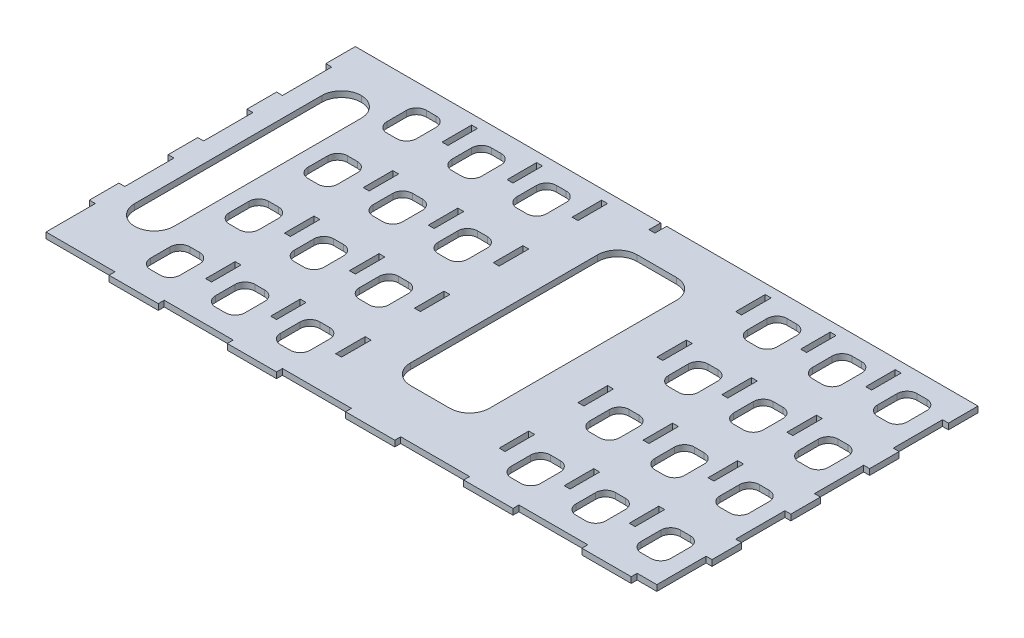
SolidWorks part; units mm, degrees
ref_plane "Front Plane" through (0, 0, 0) normal (0, 0, 1) x (1, 0, 0)
ref_plane "Top Plane" through (0, 0, 0) normal (0, 1, 0) x (1, 0, 0)
ref_plane "Right Plane" through (0, 0, 0) normal (1, 0, 0) x (0, 0, -1)
sketch "Sketch1" plane through (0, 0, 0) normal (0, 1, 0) x (1, 0, 0)
  line L0 (0, 0) -> (310, 0)
  line L1 (310, 0) -> (310, 160)
  line L2 (310, 160) -> (0, 160)
  line L3 (0, 160) -> (0, 0)
extrude "Boss-Extrude1" add sketch "Sketch1" along normal blind 3
sketch "Sketch2" plane through (0, 3, 0) normal (0, 1, 0) x (1, 0, 0)
  line L0 (0, 0) -> (35, 0) construction
  line L1 (0, 0) -> (310, 0) construction
  line L2 (35, 0) -> (60, 0) construction
  line L3 (60, 0) -> (95, 0) construction
  line L4 (95, 0) -> (120, 0) construction
  line L5 (120, 0) -> (155, 0) construction
  line L6 (155, 0) -> (180, 0) construction
  line L7 (180, 0) -> (215, 0) construction
  line L8 (215, 0) -> (240, 0) construction
  line L9 (240, 0) -> (275, 0) construction
  line L10 (275, 0) -> (300, 0) construction
  line L11 (35, 0) -> (35, -3)
  line L12 (35, -3) -> (60, -3)
  line L13 (60, -3) -> (60, 0)
  line L14 (60, 0) -> (35, 0)
  line L15 (95, 0) -> (95, -3)
  line L16 (95, -3) -> (120, -3)
  line L17 (120, -3) -> (120, 0)
  line L18 (120, 0) -> (95, 0)
  line L19 (155, 0) -> (155, -3)
  line L20 (155, -3) -> (180, -3)
  line L21 (180, -3) -> (180, 0)
  line L22 (180, 0) -> (155, 0)
  line L23 (215, 0) -> (215, -3)
  line L24 (215, -3) -> (240, -3)
  line L25 (240, -3) -> (240, 0)
  line L26 (240, 0) -> (215, 0)
  line L27 (275, 0) -> (275, -3)
  line L28 (275, -3) -> (300, -3)
  line L29 (300, -3) -> (300, 0)
  line L30 (300, 0) -> (275, 0)
  dimension "D1" = 35
  dimension "D2" = 25
  dimension "D3" = 35
  dimension "D4" = 25
  dimension "D5" = 35
  dimension "D6" = 25
  dimension "D7" = 35
  dimension "D8" = 25
  dimension "D9" = 35
  dimension "D10" = 25
extrude "Boss-Extrude2" add sketch "Sketch2" against normal blind 3
sketch "Sketch3" plane through (0, 3, 0) normal (0, 1, 0) x (1, 0, 0)
  line L0 (0, 0) -> (0, 25) construction
  line L1 (0, 160) -> (0, 0) construction
  line L2 (0, 25) -> (0, 40) construction
  line L3 (0, 40) -> (0, 65) construction
  line L4 (0, 65) -> (0, 80) construction
  line L5 (0, 80) -> (0, 105) construction
  line L6 (0, 105) -> (0, 120) construction
  line L7 (0, 120) -> (0, 145) construction
  line L8 (0, 145) -> (0, 160) construction
  line L9 (0, 160) -> (-3, 160)
  line L10 (-3, 160) -> (-3, 145)
  line L11 (-3, 145) -> (0, 145)
  line L12 (0, 160) -> (0, 145)
  line L13 (0, 120) -> (-3, 120)
  line L14 (-3, 120) -> (-3, 105)
  line L15 (-3, 105) -> (0, 105)
  line L16 (0, 105) -> (0, 120)
  line L17 (0, 80) -> (-3, 80)
  line L18 (-3, 80) -> (-3, 65)
  line L19 (-3, 65) -> (0, 65)
  line L20 (0, 65) -> (0, 80)
  line L21 (0, 40) -> (-3, 40)
  line L22 (-3, 40) -> (-3, 25)
  line L23 (-3, 25) -> (0, 25)
  line L24 (0, 25) -> (0, 40)
  line L25 (155, 0) -> (155, 160.4343) construction
  line L27 (310, 145) -> (310, 160) construction
  line L28 (310, 120) -> (310, 145) construction
  line L29 (310, 105) -> (310, 120) construction
  line L30 (310, 80) -> (310, 105) construction
  line L31 (310, 65) -> (310, 80) construction
  line L32 (310, 40) -> (310, 65) construction
  line L33 (310, 25) -> (310, 40) construction
  line L34 (310, 0) -> (310, 25) construction
  line L35 (310, 25) -> (310, 40)
  line L36 (313, 25) -> (310, 25)
  line L37 (313, 40) -> (313, 25)
  line L38 (310, 40) -> (313, 40)
  line L39 (310, 65) -> (310, 80)
  line L40 (313, 65) -> (310, 65)
  line L41 (313, 80) -> (313, 65)
  line L42 (310, 80) -> (313, 80)
  line L43 (310, 105) -> (310, 120)
  line L44 (313, 105) -> (310, 105)
  line L45 (313, 120) -> (313, 105)
  line L46 (310, 120) -> (313, 120)
  line L47 (310, 160) -> (310, 145)
  line L48 (313, 145) -> (310, 145)
  line L49 (313, 160) -> (313, 145)
  line L50 (310, 160) -> (313, 160)
  dimension "D1" = 25
  dimension "D2" = 15
  dimension "D3" = 25
  dimension "D4" = 15
  dimension "D5" = 25
  dimension "D6" = 15
  dimension "D7" = 25
extrude "Boss-Extrude3" add sketch "Sketch3" against normal blind 3
sketch "Sketch4" plane through (0, 3, 0) normal (0, 1, 0) x (1, 0, 0)
  line L0 (155, 80) -> (180, 80) construction
  line L1 (279, 0) -> (279, 160) construction
  line L2 (0, 0) -> (35, 0) construction
  line L3 (313, 160) -> (-3, 160) construction
  line L4 (279, 80) -> (246, 80) construction
  line L5 (246, 0) -> (246, 160) construction
  line L6 (246, 80) -> (213, 80) construction
  line L7 (213, 0) -> (213, 160) construction
  line L8 (180, 0) -> (180, 160) construction
  line L9 (155, 0) -> (155, 160) construction
  line L11 (180, 80) -> (213, 80) construction
  line L12 (155, 80) -> (130, 80) construction
  line L13 (130, 80) -> (97, 80) construction
  line L14 (97, 80) -> (64, 80) construction
  line L15 (130, 60) -> (130, 75) construction
  line L16 (97, 0) -> (97, 160) construction
  line L17 (64, 0) -> (64, 160) construction
  line L18 (130, 0) -> (130, 20) construction
  line L19 (130, 20) -> (130, 35) construction
  line L20 (130, 35) -> (130, 60) construction
  line L21 (130, 75) -> (130, 100) construction
  line L22 (130, 100) -> (130, 115) construction
  line L23 (130, 115) -> (130, 140) construction
  line L24 (130, 140) -> (130, 155) construction
  line L25 (130, 20) -> (130, 35)
  line L26 (130, 35) -> (127, 35)
  line L27 (127, 35) -> (127, 20)
  line L28 (127, 20) -> (130, 20)
  line L29 (130, 60) -> (127, 60)
  line L30 (127, 60) -> (127, 75)
  line L31 (127, 75) -> (130, 75)
  line L32 (130, 75) -> (130, 60)
  line L33 (130, 100) -> (130, 115)
  line L34 (130, 115) -> (127, 115)
  line L35 (127, 115) -> (127, 100)
  line L36 (127, 100) -> (130, 100)
  line L37 (130, 140) -> (130, 155)
  line L38 (130, 155) -> (127, 155)
  line L39 (127, 155) -> (127, 140)
  line L40 (127, 140) -> (130, 140)
  line L41 (94, 35) -> (94, 20)
  line L42 (94, 20) -> (97, 20)
  line L43 (97, 20) -> (97, 35)
  line L44 (97, 35) -> (94, 35)
  line L45 (94, 60) -> (94, 75)
  line L46 (97, 75) -> (97, 60)
  line L47 (97, 60) -> (94, 60)
  line L48 (94, 75) -> (97, 75)
  line L49 (94, 115) -> (94, 100)
  line L50 (94, 100) -> (97, 100)
  line L51 (97, 100) -> (97, 115)
  line L52 (97, 115) -> (94, 115)
  line L53 (94, 155) -> (94, 140)
  line L54 (94, 140) -> (97, 140)
  line L55 (97, 140) -> (97, 155)
  line L56 (97, 155) -> (94, 155)
  line L57 (61, 35) -> (61, 20)
  line L58 (61, 20) -> (64, 20)
  line L59 (64, 20) -> (64, 35)
  line L60 (64, 35) -> (61, 35)
  line L61 (61, 60) -> (61, 75)
  line L62 (64, 75) -> (64, 60)
  line L63 (64, 60) -> (61, 60)
  line L64 (61, 75) -> (64, 75)
  line L65 (61, 115) -> (61, 100)
  line L66 (61, 100) -> (64, 100)
  line L67 (64, 100) -> (64, 115)
  line L68 (64, 115) -> (61, 115)
  line L69 (61, 155) -> (61, 140)
  line L70 (61, 140) -> (64, 140)
  line L71 (64, 140) -> (64, 155)
  line L72 (64, 155) -> (61, 155)
  line L73 (213, 20) -> (213, 35)
  line L74 (213, 35) -> (210, 35)
  line L75 (210, 35) -> (210, 20)
  line L76 (210, 20) -> (213, 20)
  line L77 (213, 60) -> (210, 60)
  line L78 (210, 60) -> (210, 75)
  line L79 (210, 75) -> (213, 75)
  line L80 (213, 75) -> (213, 60)
  line L81 (213, 100) -> (213, 115)
  line L82 (213, 115) -> (210, 115)
  line L83 (210, 115) -> (210, 100)
  line L84 (210, 100) -> (213, 100)
  line L85 (213, 140) -> (213, 155)
  line L86 (210, 155) -> (210, 140)
  line L87 (210, 140) -> (213, 140)
  line L88 (238, 80) -> (213, 80) construction
  line L89 (213, 80) -> (180, 80) construction
  line L90 (213, 60) -> (213, 75) construction
  line L91 (213, 0) -> (213, 20) construction
  line L92 (213, 20) -> (213, 35) construction
  line L93 (213, 35) -> (213, 60) construction
  line L94 (213, 75) -> (213, 100) construction
  line L95 (213, 100) -> (213, 115) construction
  line L96 (213, 115) -> (213, 140) construction
  line L97 (213, 140) -> (213, 155) construction
  line L98 (246, 20) -> (246, 35)
  line L99 (246, 35) -> (243, 35)
  line L100 (243, 35) -> (243, 20)
  line L101 (243, 20) -> (246, 20)
  line L102 (246, 60) -> (243, 60)
  line L103 (243, 60) -> (243, 75)
  line L104 (243, 75) -> (246, 75)
  line L105 (246, 75) -> (246, 60)
  line L106 (246, 100) -> (246, 115)
  line L107 (246, 115) -> (243, 115)
  line L108 (243, 115) -> (243, 100)
  line L109 (243, 100) -> (246, 100)
  line L110 (246, 140) -> (246, 155)
  line L111 (243, 155) -> (243, 140)
  line L112 (243, 140) -> (246, 140)
  line L113 (246, 60) -> (246, 75) construction
  line L114 (246, 20) -> (246, 35) construction
  line L115 (246, 35) -> (246, 60) construction
  line L116 (246, 75) -> (246, 100) construction
  line L117 (246, 100) -> (246, 115) construction
  line L118 (246, 115) -> (246, 140) construction
  line L119 (246, 140) -> (246, 155) construction
  line L120 (279, 20) -> (279, 35)
  line L121 (279, 35) -> (276, 35)
  line L122 (276, 35) -> (276, 20)
  line L123 (276, 20) -> (279, 20)
  line L124 (279, 60) -> (276, 60)
  line L125 (276, 60) -> (276, 75)
  line L126 (276, 75) -> (279, 75)
  line L127 (279, 75) -> (279, 60)
  line L128 (279, 100) -> (279, 115)
  line L129 (279, 115) -> (276, 115)
  line L130 (276, 115) -> (276, 100)
  line L131 (276, 100) -> (279, 100)
  line L132 (279, 140) -> (279, 155)
  line L133 (276, 155) -> (276, 140)
  line L134 (276, 140) -> (279, 140)
  line L135 (279, 60) -> (279, 75) construction
  line L136 (279, 20) -> (279, 35) construction
  line L137 (279, 35) -> (279, 60) construction
  line L138 (279, 75) -> (279, 100) construction
  line L139 (279, 100) -> (279, 115) construction
  line L140 (279, 115) -> (279, 140) construction
  line L141 (279, 140) -> (279, 155) construction
  line L142 (210, 155) -> (213, 155)
  line L143 (243, 155) -> (246, 155)
  line L144 (276, 155) -> (279, 155)
  dimension "D1" = 33
  dimension "D2" = 33
  dimension "D3" = 33
  dimension "D4" = 25
  dimension "D5" = 25
  dimension "D6" = 33
  dimension "D7" = 20
  dimension "D8" = 15
  dimension "D9" = 25
  dimension "D10" = 20
  dimension "D11" = 15
  dimension "D12" = 15
  dimension "D13" = 25
  dimension "D14" = 15
  dimension "D15" = 3
  dimension "D16" = 2
  dimension "D17" = 3
extrude "Cut-Extrude1" cut sketch "Sketch4" against normal blind 10
sketch "Sketch5" plane through (0, 3, 0) normal (0, 1, 0) x (1, 0, 0)
  line L0 (210, 67.5) -> (130, 67.5) construction
  line L1 (210, 75) -> (210, 60) construction
  line L2 (130, 60) -> (130, 75) construction
  line L3 (170, 140) -> (150, 140)
  line L4 (313, 160) -> (-3, 160) construction
  line L5 (170, 113.75) -> (150, 113.75) construction
  line L6 (170, 160) -> (170, 140) construction
  line L7 (150, 140) -> (150, 25)
  line L8 (150, 25) -> (190, 25)
  line L9 (190, 25) -> (190, 140)
  line L10 (190, 140) -> (170, 140)
  line L11 (30, 140) -> (10, 140)
  line L12 (10, 140) -> (10, 25)
  line L16 (30, 113.75) -> (10, 113.75) construction
  line L17 (50, 25) -> (50, 140)
  line L18 (50, 140) -> (30, 140)
  line L19 (10, 25) -> (50, 25)
  line L20 (30, 140) -> (30, 25)
  line L21 (30, 25) -> (10, 25)
  dimension "D1" = 2
extrude "Cut-Extrude2" cut sketch "Sketch5" against normal blind 10
fillet "Fillet1" radius 10 8 edges at (150, 1.5, -140) (190, 1.5, -140) (190, 1.5, -25) (150, 1.5, -25) (30, 1.5, -140) (10, 1.5, -140) (30, 1.5, -25) (10, 1.5, -25)
sketch "Sketch6" plane through (0, 3, 0) normal (0, 1, 0) x (1, 0, 0)
  line L0 (61, 20) -> (61, 0) construction
  line L1 (0, 0) -> (35, 0) construction
  line L2 (61, 10) -> (53, 10) construction
  line L3 (53, 10) -> (53, 30)
  line L4 (53, 30) -> (38, 30)
  line L5 (38, 30) -> (38, 10)
  line L6 (38, 10) -> (53, 10)
  line L7 (71, 10) -> (86, 10)
  line L8 (71, 30) -> (71, 10)
  line L9 (86, 30) -> (71, 30)
  line L10 (86, 10) -> (86, 30)
  line L11 (104, 10) -> (119, 10)
  line L12 (104, 30) -> (104, 10)
  line L13 (119, 30) -> (104, 30)
  line L14 (119, 10) -> (119, 30)
  line L15 (71, 50) -> (86, 50)
  line L16 (71, 70) -> (71, 50)
  line L17 (86, 70) -> (71, 70)
  line L18 (86, 50) -> (86, 70)
  line L19 (104, 50) -> (119, 50)
  line L20 (104, 70) -> (104, 50)
  line L21 (119, 70) -> (104, 70)
  line L22 (119, 50) -> (119, 70)
  line L23 (71, 90) -> (86, 90)
  line L24 (71, 110) -> (71, 90)
  line L25 (86, 110) -> (71, 110)
  line L26 (86, 90) -> (86, 110)
  line L27 (104, 90) -> (119, 90)
  line L28 (104, 110) -> (104, 90)
  line L29 (119, 110) -> (104, 110)
  line L30 (119, 90) -> (119, 110)
  line L31 (71, 130) -> (86, 130)
  line L32 (71, 150) -> (71, 130)
  line L33 (86, 150) -> (71, 150)
  line L34 (86, 130) -> (86, 150)
  line L35 (104, 130) -> (119, 130)
  line L36 (104, 150) -> (104, 130)
  line L37 (119, 150) -> (104, 150)
  line L38 (119, 130) -> (119, 150)
  line L39 (38, 50) -> (53, 50)
  line L40 (38, 70) -> (38, 50)
  line L41 (53, 70) -> (38, 70)
  line L42 (53, 50) -> (53, 70)
  line L43 (38, 90) -> (53, 90)
  line L44 (38, 110) -> (38, 90)
  line L45 (53, 110) -> (38, 110)
  line L46 (53, 90) -> (53, 110)
  line L47 (38, 130) -> (53, 130)
  line L48 (38, 150) -> (38, 130)
  line L49 (53, 150) -> (38, 150)
  line L50 (53, 130) -> (53, 150)
  line L51 (279, 20) -> (279, 0) construction
  line L52 (279, 10) -> (287, 10) construction
  line L53 (287, 10) -> (287, 30)
  line L54 (287, 30) -> (302, 30)
  line L55 (302, 30) -> (302, 10)
  line L56 (302, 10) -> (287, 10)
  line L57 (254, 10) -> (254, 30)
  line L58 (269, 10) -> (254, 10)
  line L59 (254, 30) -> (269, 30)
  line L60 (269, 30) -> (269, 10)
  line L61 (221, 10) -> (221, 30)
  line L62 (236, 10) -> (221, 10)
  line L63 (221, 30) -> (236, 30)
  line L64 (236, 30) -> (236, 10)
  line L65 (254, 50) -> (254, 70)
  line L66 (269, 50) -> (254, 50)
  line L67 (254, 70) -> (269, 70)
  line L68 (269, 70) -> (269, 50)
  line L69 (221, 50) -> (221, 70)
  line L70 (236, 50) -> (221, 50)
  line L71 (221, 70) -> (236, 70)
  line L72 (236, 70) -> (236, 50)
  line L73 (254, 90) -> (254, 110)
  line L74 (269, 90) -> (254, 90)
  line L75 (254, 110) -> (269, 110)
  line L76 (269, 110) -> (269, 90)
  line L77 (221, 90) -> (221, 110)
  line L78 (236, 90) -> (221, 90)
  line L79 (221, 110) -> (236, 110)
  line L80 (236, 110) -> (236, 90)
  line L81 (254, 130) -> (254, 150)
  line L82 (269, 130) -> (254, 130)
  line L83 (254, 150) -> (269, 150)
  line L84 (269, 150) -> (269, 130)
  line L85 (221, 130) -> (221, 150)
  line L86 (236, 130) -> (221, 130)
  line L87 (221, 150) -> (236, 150)
  line L88 (236, 150) -> (236, 130)
  line L89 (287, 50) -> (287, 70)
  line L90 (302, 50) -> (287, 50)
  line L91 (287, 70) -> (302, 70)
  line L92 (302, 70) -> (302, 50)
  line L93 (287, 90) -> (287, 110)
  line L94 (302, 90) -> (287, 90)
  line L95 (287, 110) -> (302, 110)
  line L96 (302, 110) -> (302, 90)
  line L97 (287, 130) -> (287, 150)
  line L98 (302, 130) -> (287, 130)
  line L99 (287, 150) -> (302, 150)
  line L100 (302, 150) -> (302, 130)
  dimension "D1" = 3
  dimension "D3" = 3
  dimension "D2" = 4
  dimension "D4" = 4
extrude "Cut-Extrude3" cut sketch "Sketch6" against normal blind 10
fillet "Fillet2" radius 5 96 edges at (236, 1.5, -130) (269, 1.5, -130) (302, 1.5, -130) (236, 1.5, -90) (269, 1.5, -90) (302, 1.5, -90) (302, 1.5, -50) (269, 1.5, -50) (236, 1.5, -50) (236, 1.5, -10) (269, 1.5, -10) (302, 1.5, -10) (302, 1.5, -30) (269, 1.5, -30) (236, 1.5, -30) (236, 1.5, -70) (269, 1.5, -70) (302, 1.5, -70) (302, 1.5, -110) (269, 1.5, -110) (236, 1.5, -110) (236, 1.5, -150) (269, 1.5, -150) (302, 1.5, -150) (287, 1.5, -50) (287, 1.5, -90) (287, 1.5, -130) (254, 1.5, -90) (254, 1.5, -130) (221, 1.5, -130) (221, 1.5, -90) (254, 1.5, -50) (221, 1.5, -50) (287, 1.5, -10) (254, 1.5, -10) (221, 1.5, -10) (254, 1.5, -30) (287, 1.5, -30) (287, 1.5, -70) (254, 1.5, -70) (221, 1.5, -30) (221, 1.5, -70) (287, 1.5, -150) (287, 1.5, -110) (254, 1.5, -110) (254, 1.5, -150) (221, 1.5, -110) (221, 1.5, -150) (119, 1.5, -110) (119, 1.5, -90) (119, 1.5, -130) (119, 1.5, -150) (104, 1.5, -130) (104, 1.5, -90) (71, 1.5, -50) (86, 1.5, -50) (119, 1.5, -70) (104, 1.5, -50) (104, 1.5, -10) (104, 1.5, -30) (119, 1.5, -30) (86, 1.5, -30) (71, 1.5, -10) (119, 1.5, -50) (119, 1.5, -10) (86, 1.5, -10) (71, 1.5, -30) (104, 1.5, -150) (104, 1.5, -110) (104, 1.5, -70) (71, 1.5, -70) (71, 1.5, -150) (71, 1.5, -110) (71, 1.5, -130) (86, 1.5, -130) (86, 1.5, -90) (53, 1.5, -130) (38, 1.5, -150) (38, 1.5, -130) (71, 1.5, -90) (86, 1.5, -70) (86, 1.5, -110) (86, 1.5, -150) (53, 1.5, -150) (53, 1.5, -110) (38, 1.5, -110) (53, 1.5, -90) (38, 1.5, -90) (38, 1.5, -50) (38, 1.5, -70) (53, 1.5, -70) (53, 1.5, -50) (53, 1.5, -10) (53, 1.5, -30) (38, 1.5, -30) (38, 1.5, -10)
sketch "Sketch8" plane through (0, 3, 0) normal (0, 1, 0) x (1, 0, 0)
  line L0 (276, 20) -> (276, 0) construction
  line L1 (0, 0) -> (35, 0) construction
  line L2 (275, 0) -> (276, 0) construction
  line L3 (127, 20) -> (127, 0) construction
  line L4 (120, 0) -> (127, 0) construction
sketch "Esquisse1" plane through (0, 3, 0) normal (0, 1, 0) x (1, 0, 0)
  line L0 (-3, 160) -> (152, 160) construction
  line L1 (313, 160) -> (-3, 160) construction
  line L2 (152, 160) -> (152, 154) construction
  line L3 (152, 154) -> (155, 154) construction
  line L4 (155, 154) -> (155, 160) construction
  line L5 (155, 160) -> (152, 160) construction
  line L6 (152, 160) -> (155, 160)
  line L7 (155, 160) -> (155, 154)
  line L8 (155, 154) -> (152, 154)
  line L9 (152, 154) -> (152, 160)
extrude "Enlèv. mat.-Extru.1" cut sketch "Esquisse1" against normal blind 10
